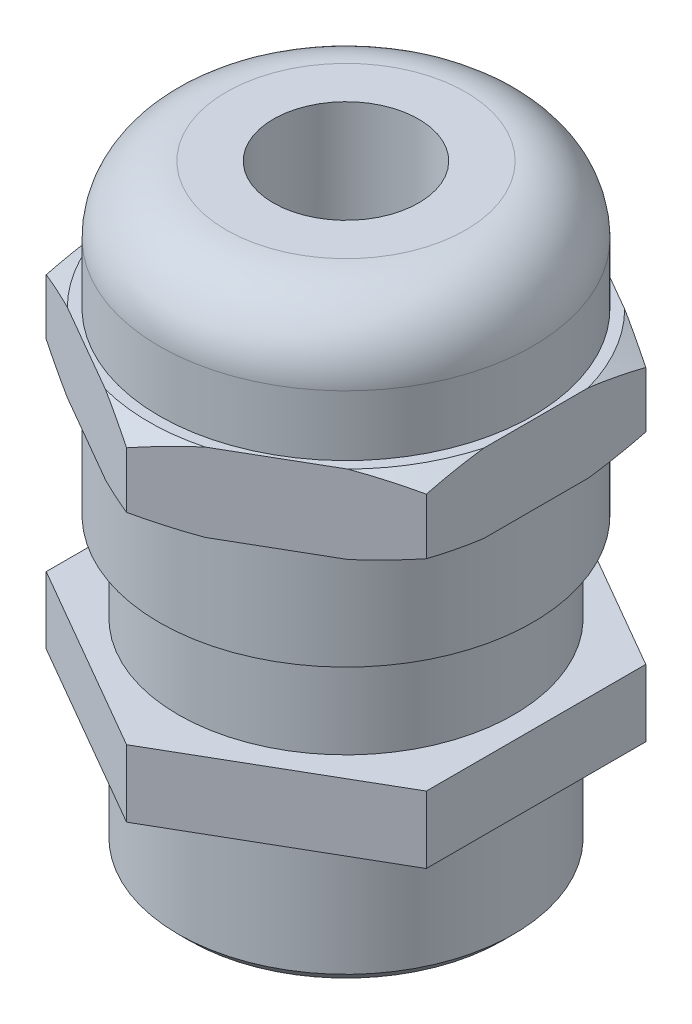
SolidWorks part; units mm, degrees
ref_plane "Piano frontale" through (0, 0, 0) normal (0, 0, 1) x (1, 0, 0)
ref_plane "Piano superiore" through (0, 0, 0) normal (0, 1, 0) x (1, 0, 0)
ref_plane "Piano destro" through (0, 0, 0) normal (1, 0, 0) x (0, 0, -1)
ref_plane "Piano6" through (0, 3, 0) normal (0, 1, 0) x (-1, 0, 0)
sketch "Schizzo13" plane through (0, 3, 0) normal (0, 1, 0) x (-1, 0, 0)
  line L0 (0, -9.815) -> (8.5, -4.9075)
  line L1 (8.5, -4.9075) -> (8.5, 4.9075)
  line L2 (8.5, 4.9075) -> (0, 9.815)
  line L3 (0, 9.815) -> (-8.5, 4.9075)
  line L4 (-8.5, 4.9075) -> (-8.5, -4.9075)
  line L5 (-8.5, -4.9075) -> (0, -9.815)
  circle A0 centre (0, 0) radius 9.815 construction
  dimension "D1" = 17
extrude "Estrusione1" add sketch "Schizzo13" against normal blind 3
sketch "Schizzo14" plane through (0, 3, 0) normal (0, 1, 0) x (-1, 0, 0)
  circle A0 centre (0, 0) radius 7.5
  dimension "D1" = 15
extrude "Estrusione2" add sketch "Schizzo14" along normal blind 4
sketch "Schizzo15" plane through (0, 7, 0) normal (0, 1, 0) x (-1, 0, 0)
  circle A0 centre (0, 0) radius 7.5
  dimension "D1" = 15
extrude "Estrusione3" add sketch "Schizzo15" against normal blind 4.5
sketch "Schizzo21" plane through (0, 7, 0) normal (0, 1, 0) x (-1, 0, 0)
  circle A0 centre (0, 0) radius 8.35
  dimension "D1" = 16.7
extrude "Estrusione5" add sketch "Schizzo21" along normal blind 4.5
sketch "Schizzo16" plane through (0, 11.5, 0) normal (0, -1, 0) x (1, 0, 0)
  line L0 (8.5, 4.9075) -> (0, 9.815)
  line L1 (0, 9.815) -> (-8.5, 4.9075)
  line L2 (-8.5, 4.9075) -> (-8.5, -4.9075)
  line L3 (-8.5, -4.9075) -> (0, -9.815)
  line L4 (0, -9.815) -> (8.5, -4.9075)
  line L5 (8.5, -4.9075) -> (8.5, 4.9075)
  circle A0 centre (0, 0) radius 9.815 construction
  dimension "D1" = 17
extrude "Estrusione4" add sketch "Schizzo16" against normal blind 3.5
sketch "Schizzo17" plane through (0, 0, 0) normal (0, 0, 1) x (1, 0, 0)
  line L0 (-8.35, 15) -> (0, 15)
  line L1 (0, 15) -> (0, 20.7) construction
  line L2 (0, 20.7) -> (-8.35, 20.7)
  line L3 (-8.35, 20.7) -> (-8.35, 15)
  line L4 (0, 15) -> (0, 20.7) construction
  line L5 (8.5, 15) -> (0, 15) construction
  line L6 (0, -10.7965) -> (0, 10.7965) construction
  line L7 (0, 20.7) -> (0, 15)
  dimension "D1" = 16.7
  dimension "D2" = 5.7
revolve "Rivoluzione7" add sketch "Schizzo17" angle 360 about L1
sketch "Schizzo18" plane through (0, 0, 0) normal (0, 0, 1) x (1, 0, 0)
  line L0 (-7.5, -6) -> (0, -6)
  line L1 (0, -6) -> (0, 0) construction
  line L2 (0, 0) -> (-7.5, 0)
  line L3 (-7.5, 0) -> (-7.5, -6)
  line L4 (0, -6) -> (0, 0) construction
  line L5 (0, 0) -> (0, -6)
  dimension "D1" = 15
  dimension "D2" = 6
revolve "Rivoluzione8" add sketch "Schizzo18" angle 360 about L1
hole_wizard "Foro4" positions "Schizzo20" profile "Schizzo19" legacy
sketch "Schizzo20" plane through (0, 20.7, 0) normal (0, 1, 0) x (-1, 0, 0)
  point P0 (0, 0)
sketch "Schizzo19" plane through (0, 20.7, 0) normal (1, 0, 0) x (0, 0, 1)
  line L0 (0, 0) -> (0, 26.7)
  line L1 (0, 26.7) -> (3.25, 26.7)
  line L2 (3.25, 26.7) -> (3.25, 0)
  line L3 (3.25, 0) -> (0, 0)
  line L4 (0, 110) -> (0, -10) construction
  dimension "Diameter" = 6.5
  dimension "Depth" = 26.7
chamfer "Smusso4" distance 0.5 angle 45 1 edges at (0, -6, 7.5)
fillet "Raccordo4" radius 3 1 edges at (0, 20.7, 8.35)
sketch "Schizzo22" plane through (0, 0, 0) normal (1, 0, 0) x (0, 0, -1)
  line L0 (-9.815, 15) -> (-9.815, 11.5) construction
  line L1 (-9.815, 15) -> (-9.815, 14.5)
  line L4 (-9.815, 15) -> (-8.815, 15)
  line L5 (-8.815, 15) -> (-9.815, 14.5)
  line L6 (-9.815, 11.5) -> (-8.815, 11.5)
  line L7 (-8.815, 11.5) -> (-9.815, 12)
  line L12 (-9.815, 12) -> (-9.815, 11.5)
  dimension "D1" = 1
  dimension "D2" = 0.5
revolve "Taglia-Rivoluzione1" cut sketch "Schizzo22" angle 360 about axis through (0, 20.7, 0) along (0, 1, 0)
sketch "Schizzo23" plane through (0, -6, 0) normal (0, -1, 0) x (1, 0, 0)
  circle A0 centre (0, 0) radius 4.25
  dimension "D1" = 8.5
extrude "Taglio-Estrusione1" cut sketch "Schizzo23" against normal blind 20
